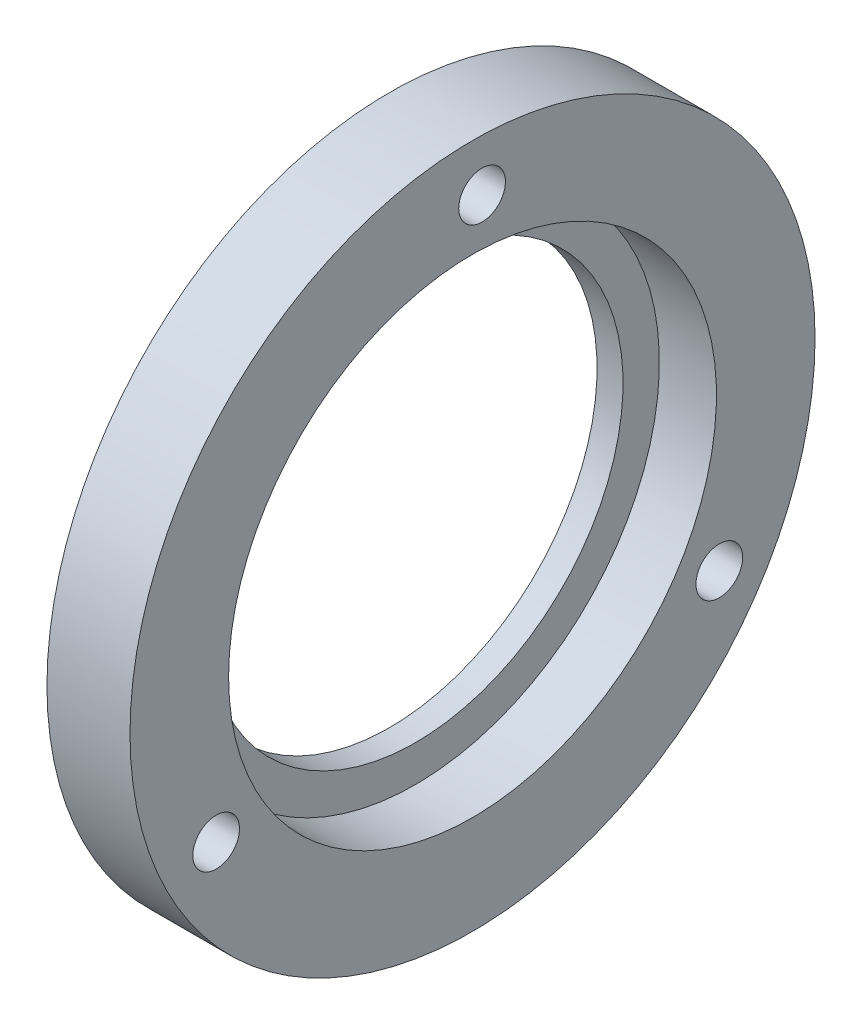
SolidWorks part; units mm, degrees
ref_plane "Plan de face" through (0, 0, 0) normal (0, 0, 1) x (1, 0, 0)
ref_plane "Plan de dessus" through (0, 0, 0) normal (0, 1, 0) x (1, 0, 0)
ref_plane "Plan de droite" through (0, 0, 0) normal (1, 0, 0) x (0, 0, -1)
sketch "Esquisse1" plane through (0, 0, 0) normal (0, 0, 1) x (1, 0, 0)
  line L0 (-15.1382, 0) -> (27.7534, 0) construction
  line L1 (0, 20) -> (0, 33)
  line L2 (0, 33) -> (8, 33)
  line L3 (8, 33) -> (8, 23.5)
  line L4 (8, 23.5) -> (2.5, 23.5)
  line L5 (2.5, 23.5) -> (2.5, 20)
  line L6 (2.5, 20) -> (0, 20)
  dimension "D1" = 66
  dimension "D2" = 40
  dimension "D3" = 47
  dimension "D4" = 8
  dimension "D5" = 5.5
revolve "Révolution1" add sketch "Esquisse1" angle 360 about L0
hole_wizard "Chambrage pour vis à tête hexagonale M41" positions "Esquisse3D1" profile "Esquisse2" counterbore size "M4" standard "ISO"
sketch3d "Esquisse3D1"
  point P0 (0, 27.9848, -0.9219)
  dimension "D1" = 28
sketch "Esquisse2" plane through (0, 27.9848, -0.9219) normal (0, 1, 0) x (0, 0, 1)
  line L0 (0, 0) -> (0, 8)
  line L1 (0, 8) -> (2.25, 8)
  line L3 (2.25, 8) -> (2.25, 4)
  line L4 (2.25, 4) -> (4, 4)
  line L5 (4, 4) -> (4, 0)
  line L7 (4, 0) -> (0, 0)
  line L11 (0, -6.35) -> (0, 107.95) construction
  dimension "Diamètre du perçage jusqu'au prochain" = 4.5
  dimension "Profondeur du perçage jusqu'au prochain" = 8
  dimension "Diamètre du chambrage" = 8
  dimension "Profondeur du chambrage" = 4
pattern_circular "Répétition circulaire1" count 3 every 120 about axis through (0, 0, 0) along (1, 0, 0) of "Chambrage pour vis à tête hexagonale M41"
